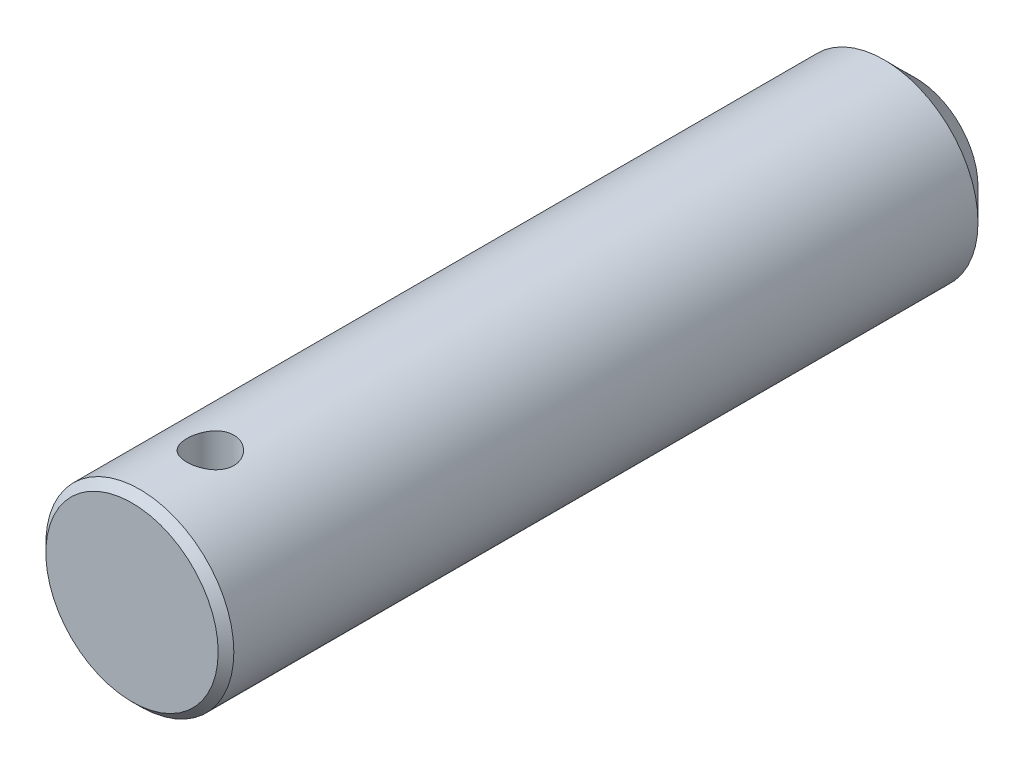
SolidWorks part; units mm, degrees
ref_plane "Plan de face" through (0, 0, 0) normal (0, 0, 1) x (1, 0, 0)
ref_plane "Plan de dessus" through (0, 0, 0) normal (0, 1, 0) x (1, 0, 0)
ref_plane "Plan de droite" through (0, 0, 0) normal (1, 0, 0) x (0, 0, -1)
sketch "Esquisse1" plane through (0, 0, 0) normal (0, 0, 1) x (1, 0, 0)
  circle A0 centre (0, 0) radius 6
extrude "Extrusion1" add sketch "Esquisse1" along normal blind 50
chamfer "Chanfrein2" distance 2 angle 45 1 edges at (6, 0, 0)
sketch "Esquisse2" plane through (0, 0, 0) normal (0, 1, 0) x (1, 0, 0)
  line L0 (-6, -50) -> (6, -50) construction
  circle A0 centre (0, -45) radius 1.5
  dimension "D1" = 5
extrude "Enlèv. mat.-Extru.1" cut sketch "Esquisse2" against normal mid plane 20
chamfer "Chanfrein3" distance 0.5 angle 45 1 edges at (6, 0, 50)
